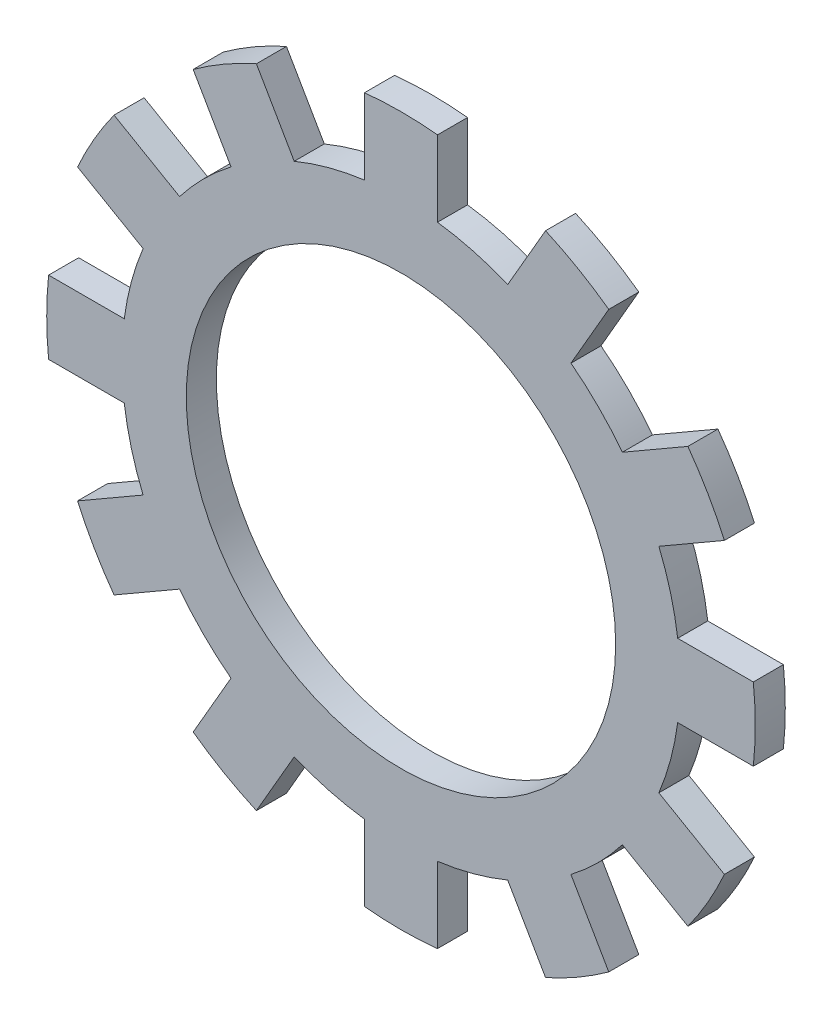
SolidWorks part; units mm, degrees
ref_plane "Front Plane" through (0, 0, 0) normal (0, 0, 1) x (1, 0, 0)
ref_plane "Top Plane" through (0, 0, 0) normal (0, 1, 0) x (1, 0, 0)
ref_plane "Right Plane" through (0, 0, 0) normal (1, 0, 0) x (0, 0, -1)
sketch "Sketch1" plane through (0, 0, 0) normal (0, 0, 1) x (1, 0, 0)
  circle A0 centre (0, 0) radius 10
  circle A1 centre (0, 0) radius 13
  dimension "D1" = 20
  dimension "D2" = 26
extrude "Boss-Extrude1" add sketch "Sketch1" along normal mid plane 1.4
sketch "Sketch2" plane through (0, 0, 0) normal (0, 0, 1) x (1, 0, 0)
  line L0 (0, 2.6811) -> (0, -2.8425) construction
sketch "Sketch3" plane through (0, 0, 0) normal (0, 0, 1) x (1, 0, 0)
  line L0 (-1.7, 16.4122) -> (-1.7, 12.8884)
  line L2 (0, 2.6811) -> (0, -2.8425) construction
  line L3 (0, 13) -> (0, 16.5)
  arc A0 (0, 16.5) -> (-1.7, 16.4122) centre (0, 0) ccw
  arc A1 (0, 13) -> (-1.7, 12.8884) centre (0, 0) ccw
  circle A2 centre (0, 0) radius 13 construction
  dimension "D2" = 16.5
  dimension "D1" = 1.7
extrude "Boss-Extrude2" add sketch "Sketch3" along normal mid plane 1.4
mirror "Mirror1" about plane through (0, 0, 0) normal (1, 0, 0) of "Boss-Extrude2"
pattern_circular "CirPattern2" count 12 over 360 about axis through (0, 0, 0) along (0, 0, 1) of "Boss-Extrude2", "Mirror1"
